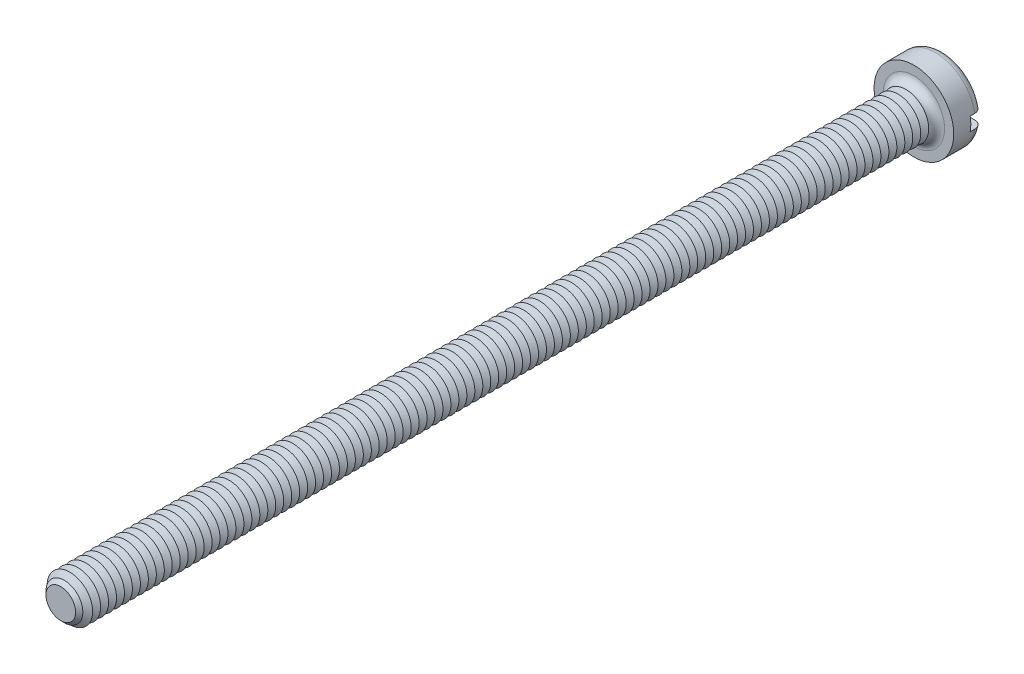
SolidWorks part; units mm, degrees
ref_plane "Front Plane" through (0, 0, 0) normal (0, 0, 1) x (1, 0, 0)
ref_plane "Top Plane" through (0, 0, 0) normal (0, 1, 0) x (1, 0, 0)
ref_plane "Right Plane" through (0, 0, 0) normal (1, 0, 0) x (0, 0, -1)
sketch "Sketch3" plane through (0, 0, 0) normal (0, 0, 1) x (1, 0, 0)
  circle A0 centre (0, 0) radius 3.5
  dimension "D1" = 7
extrude "Boss-Extrude2" add sketch "Sketch3" against normal blind 2.6
sketch "Sketch4" plane through (0, 0, 0) normal (0, 0, 1) x (1, 0, 0)
  circle A0 centre (0, 0) radius 2
  dimension "D1" = 4
extrude "Boss-Extrude3" add sketch "Sketch4" along normal blind 75
fillet "Fillet1" radius 0.7 2 edges at (3.5, 0, -2.6) (2, 0, 0)
chamfer "Chamfer1" distance 0.7 angle 45 1 edges at (2, 0, 75)
sketch "Sketch5" plane through (0, 0, 0) normal (1, 0, 0) x (0, 0, -1)
  line L0 (1.6944, 0) -> (-7.6738, 0) construction
sketch "Sketch6" plane through (0, 0, 0) normal (1, 0, 0) x (0, 0, -1)
  line L0 (-0.7, 2) -> (-1.05, 1.3938)
  line L1 (-1.05, 1.3938) -> (-1.4, 2)
  line L2 (-0.7, 2) -> (-74.3, 2) construction
  line L3 (-1.4, 2) -> (-0.7, 2)
  dimension "D1" = 0.7
revolve "Cut-Revolve1" cut sketch "Sketch6" angle 360 about L0
pattern_linear "LPattern1" count 106 spacing 0.7 along (0, 0, 1) of "Cut-Revolve1"
sketch "Sketch8" plane through (0, 0, -2.6) normal (0, 0, -1) x (-1, 0, 0)
  line L1 (3.5, -0.6) -> (-3.5, -0.6)
  line L2 (3.5, -0.6) -> (3.5, 0.6)
  line L3 (3.5, 0.6) -> (-3.5, 0.6)
  line L4 (-3.5, -0.6) -> (-3.5, 0.6)
  line L5 (3.5, -0.6) -> (-3.5, 0.6) construction
  line L6 (3.5, 0.6) -> (-3.5, -0.6) construction
  point P0 (0, 0)
  dimension "D1" = 7
  dimension "D2" = 1.2
extrude "Cut-Extrude1" cut sketch "Sketch8" against normal blind 1.1
